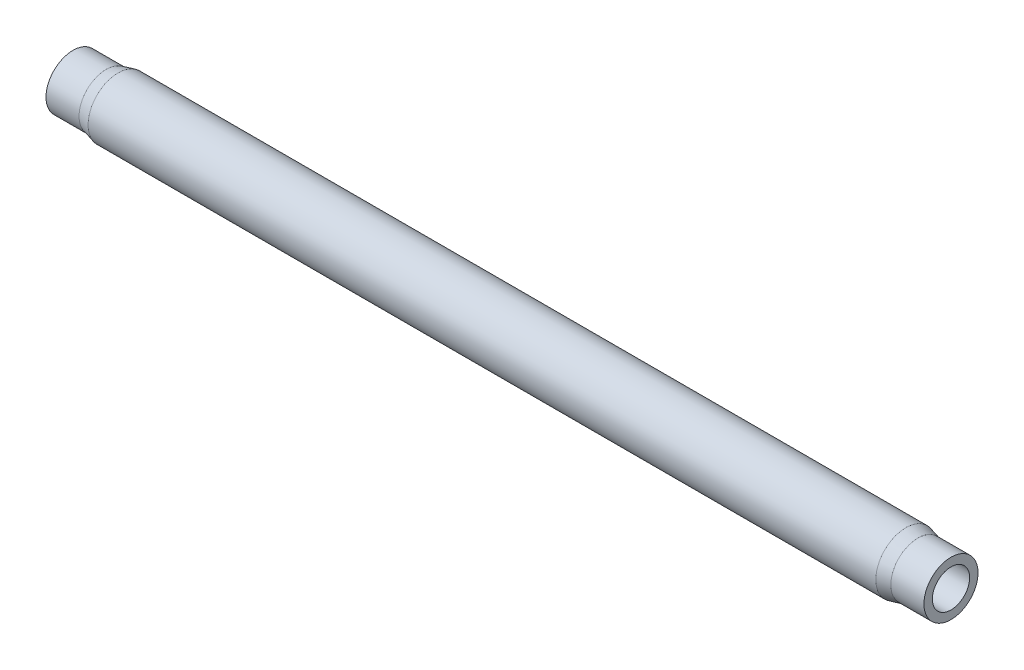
SolidWorks part; units mm, degrees
ref_plane "Plan1" through (0, 0, 0) normal (0, 0, 1) x (1, 0, 0)
ref_plane "Plan2" through (0, 0, 0) normal (0, 1, 0) x (1, 0, 0)
ref_plane "Plan3" through (0, 0, 0) normal (1, 0, 0) x (0, 0, -1)
sketch "Esquisse1" plane through (0, 0, 0) normal (0, 0, 1) x (1, 0, 0)
  line L0 (0, 3.1) -> (0, 4.5)
  line L1 (146, 4.5) -> (140.5, 4.5)
  line L2 (140.5, 4.5) -> (138.5, 5)
  line L3 (138.5, 5) -> (7.5, 5)
  line L4 (7.5, 5) -> (5.5, 4.5)
  line L5 (5.5, 4.5) -> (0, 4.5)
  line L6 (146, 4.5) -> (146, 3.1)
  line L7 (146, 3.1) -> (0, 3.1)
  line L8 (-10, 0) -> (160, 0) construction
  dimension "D1" = 3.1
  dimension "D2" = 4.5
  dimension "D3" = 5.5
  dimension "D4" = 146
  dimension "D5" = 5
  dimension "D6" = 7.5
  dimension "D7" = 5.5
  dimension "D8" = 7.5
revolve "Base-Révolution" add sketch "Esquisse1" angle 360 about L8
chamfer "Chanfrein1" [suppressed] distance 0.5 angle 45
